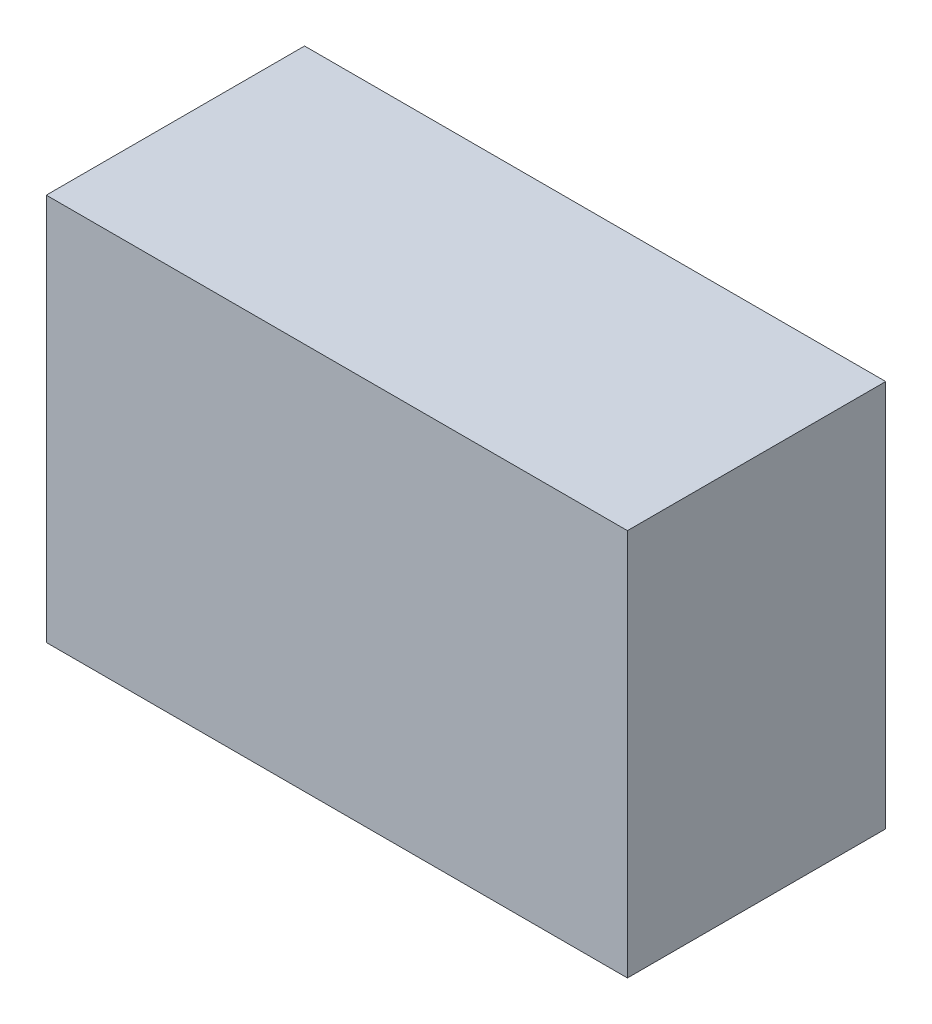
SolidWorks part; units mm, degrees
ref_plane "Plan de face" through (0, 0, 0) normal (0, 0, 1) x (1, 0, 0)
ref_plane "Plan de dessus" through (0, 0, 0) normal (0, 1, 0) x (1, 0, 0)
ref_plane "Plan de droite" through (0, 0, 0) normal (1, 0, 0) x (0, 0, -1)
sketch "Esquisse1" plane through (0, 0, 0) normal (0, 0, 1) x (1, 0, 0)
  line L0 (0, 0) -> (470.6608, 0) construction
  line L1 (0, -55.3377) -> (0, 353.7921) construction
  line L2 (0, 0) -> (442.2765, 160.9755) construction
  line L3 (0, 0) -> (360.5471, 302.5349) construction
  line L4 (0, 0) -> (235.3304, 407.6042) construction
  line L5 (0, 0) -> (81.7294, 463.5104) construction
  line L6 (0, 0) -> (-81.7294, 463.5104) construction
  line L7 (0, 0) -> (-235.3304, 407.6042) construction
  line L8 (0, 0) -> (-360.5471, 302.5349) construction
  line L9 (0, 0) -> (-442.2765, 160.9755) construction
  line L10 (0, 0) -> (-470.6608, 0) construction
  line L11 (-390.3547, -30) -> (366.2536, -30) construction
  line L12 (-390.3547, 30) -> (366.2536, 30) construction
  line L13 (-390.3547, 60) -> (366.2536, 60) construction
  line L14 (22.5, -55.3377) -> (22.5, 160.9755) construction
  line L15 (366.2536, 90) -> (-390.3547, 90) construction
  line L16 (45, -55.3377) -> (45, 160.9755) construction
  line L17 (-390.3547, 120) -> (366.2536, 120) construction
  line L18 (-90, -59.8279) -> (-90, 0) construction
  line L19 (366.2536, 150) -> (-390.3547, 150) construction
  line L20 (67.5, -55.3377) -> (67.5, 160.9755) construction
  line L21 (90, -55.3377) -> (90, 160.9755) construction
  line L22 (112.5, -55.3377) -> (112.5, 160.9755) construction
  line L23 (135, -55.3377) -> (135, 160.9755) construction
  line L24 (157.5, -55.3377) -> (157.5, 160.9755) construction
  line L25 (180, -55.3377) -> (180, 160.9755) construction
  line L26 (202.5, -55.3377) -> (202.5, 160.9755) construction
  line L27 (225, -55.3377) -> (225, 160.9755) construction
  line L29 (135, 0) -> (180, 0)
  line L30 (135, 0) -> (135, -30)
  line L31 (135, -30) -> (180, -30)
  line L32 (180, 0) -> (180, -30)
  arc A0 (90, 0) -> (-90, 0) centre (0, 0) ccw construction
  arc A1 (112, 0) -> (-112, 0) centre (0, 0) ccw construction
extrude "Extrusion1" add sketch "Esquisse1" along normal blind 20
